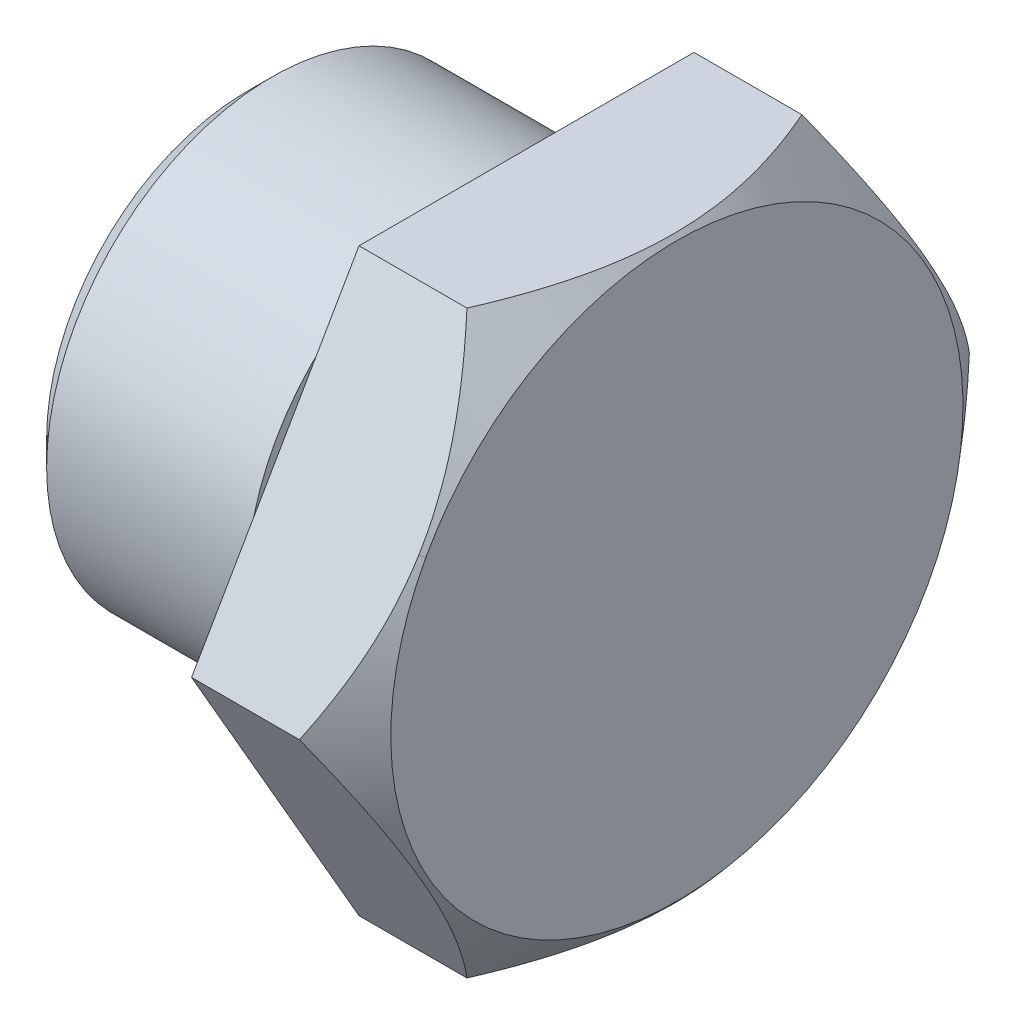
SolidWorks part; units mm, degrees
ref_plane "Plan de face" through (0, 0, 0) normal (0, 0, 1) x (1, 0, 0)
ref_plane "Plan de dessus" through (0, 0, 0) normal (0, 1, 0) x (1, 0, 0)
ref_plane "Plan de droite" through (0, 0, 0) normal (1, 0, 0) x (0, 0, -1)
imported_body "Importée1"
sketch "Esquisse1" plane through (-2.5, 0, 0) normal (1, 0, 0) x (0, 0, -1)
  circle A0 centre (0, 0) radius 9.315
  circle A2 centre (0, 0) radius 10.4975
  dimension "D1" = 18.63
  dimension "D2" = 20.995
extrude "Boss.-Extru.1" add sketch "Esquisse1" against normal up to surface (10.5 mm away)
chamfer "Chanfrein2" distance 1.165 angle 45 1 edges at (-13, 0, 10.4975)
sketch "Esquisse2" plane through (0, 0, 0) normal (0, 0, 1) x (1, 0, 0)
  line L1 (-2.5, -10.4975) -> (-2.5, 10.4975) construction
  line L2 (-2.5, 9.11) -> (0, 9.11)
  line L3 (0, 13.5) -> (0, 0) construction
  line L4 (0, 0) -> (-15.7194, 0) construction
  line L5 (-2.5, 9.11) -> (-2.5, 10.4975)
  line L6 (-2.5, 10.4975) -> (0, 10.4975)
  line L7 (0, 10.4975) -> (0, 9.11)
  dimension "D1" = 18.22
revolve "Enlèvement de matière-Révolution1" cut sketch "Esquisse2" angle 360 about L4
